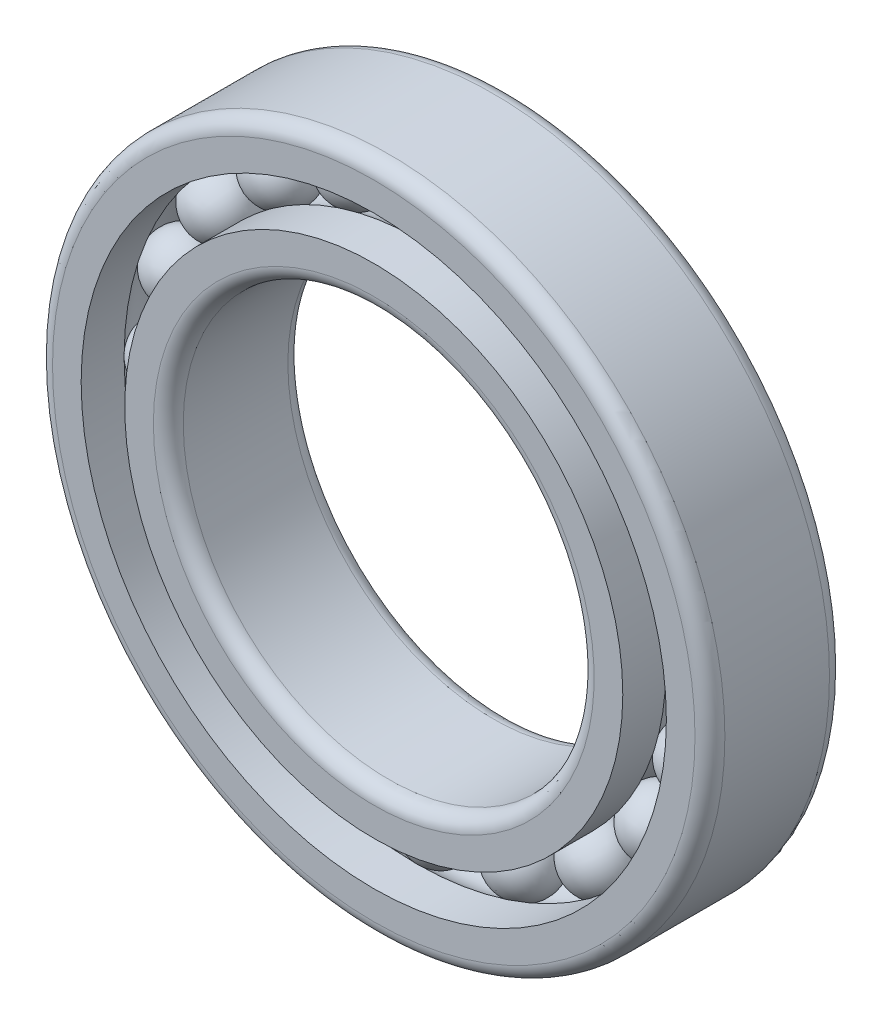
SolidWorks part; units mm, degrees
ref_plane "Front Plane" through (0, 0, 0) normal (0, 0, 1) x (1, 0, 0)
ref_plane "Top Plane" through (0, 0, 0) normal (0, 1, 0) x (1, 0, 0)
ref_plane "Right Plane" through (0, 0, 0) normal (1, 0, 0) x (0, 0, -1)
sketch "BaseSke" plane through (0, 0, 0) normal (1, 0, 0) x (0, 0, -1)
  line L0 (-47.2296, 0) -> (24.6132, 0) construction
  line L1 (-47.2296, 36.25) -> (24.6132, 36.25) construction
  line L2 (0, 129.5214) -> (0, -86.3012) construction
  line L3 (0, 40.625) -> (0, 31.875)
  line L4 (-9, 45) -> (9, 45) construction
  line L5 (-9, 27.5) -> (9, 27.5) construction
  arc A0 (0, 40.625) -> (0, 31.875) centre (0, 36.25) ccw
  dimension "Ball_diameter" = 8.75
  dimension "D1" = 36.25
  dimension "Bearing_Thickness" = 18
  dimension "Bearing_Outside_Diameter" = 90
  dimension "Bearing_Inside_Diameter" = 55
revolve "Ball" add sketch "BaseSke" angle 360 about L3
sketch "OuterRaceSke" plane through (0, 0, 0) normal (1, 0, 0) x (0, 0, -1)
  line L0 (0, 0) -> (0, 87.5396) construction
  line L1 (-9, 45) -> (9, 45)
  line L2 (-9, 45) -> (-9, 39.1667)
  line L3 (-9, 39.1667) -> (-3.2475, 39.1667)
  line L4 (9, 45) -> (9, 39.1667)
  line L5 (-50.3916, 0) -> (55.2197, 0) construction
  line L6 (-47.2296, 36.25) -> (24.6132, 36.25) construction
  line L7 (3.2475, 39.1667) -> (9, 39.1667)
  arc A0 (3.2475, 39.1667) -> (-3.2475, 39.1667) centre (0, 36.25) ccw
  dimension "D4" = 8.73
  dimension "D2" = 78.3333
revolve "OuterRace" add sketch "OuterRaceSke" angle 360 about L5
sketch "InnerRaceSke" plane through (0, 0, 0) normal (1, 0, 0) x (0, 0, -1)
  line L0 (-70.8626, 0) -> (113.5527, 0) construction
  line L1 (0, 58.441) -> (0, -70.8113) construction
  line L2 (-9, 27.5) -> (9, 27.5)
  line L3 (-9, 27.5) -> (-9, 33.3333)
  line L4 (-9, 33.3333) -> (-3.2475, 33.3333)
  line L5 (9, 27.5) -> (9, 33.3333)
  line L6 (0, 129.5214) -> (0, -86.3012) construction
  line L7 (3.2475, 33.3333) -> (9, 33.3333)
  arc A0 (-3.2475, 33.3333) -> (3.2475, 33.3333) centre (0, 36.25) ccw
  arc A1 (0, 40.625) -> (0, 31.875) centre (0, 36.25) ccw construction
  dimension "D2" = 8.73
  dimension "D1" = 66.6667
revolve "InnerRace" add sketch "InnerRaceSke" angle 360 about L0
fillet "Fillet1" radius 2 4 edges at (27.5, 0, -9) (27.5, 0, 9) (45, 0, -9) (45, 0, 9)
sketch "ShieldedSke" plane through (0, 0, 0) normal (1, 0, 0) x (0, 0, -1)
  line L1 (-8, 39.1667) -> (-6, 39.1667)
  line L2 (-9, 38.1667) -> (-9, 34.3333)
  line L3 (-8, 33.3333) -> (-6, 33.3333)
  line L4 (-6, 39.1667) -> (-6, 33.3333)
  arc A0 (-8, 39.1667) -> (-9, 38.1667) centre (-8, 38.1667) ccw
  arc A1 (-9, 34.3333) -> (-8, 33.3333) centre (-8, 34.3333) ccw
  point P12 (-9, 39.1667)
  point P13 (-9, 33.3333)
  dimension "D1" = 1
  dimension "D2" = 6
revolve "Shielded" [suppressed] add sketch "ShieldedSke" angle 360 about L0
mirror "DoubleShielded" [suppressed] about plane through (0, 0, 0) normal (0, 0, 1)
sketch "SealedSke" plane through (0, 0, 0) normal (1, 0, 0) x (0, 0, -1)
  line L0 (-34.5153, 0) -> (39.09, 0) construction
  line L1 (-27.2, 33.3333) -> (-7.2, 33.3333)
  line L2 (-27.2, 33.3333) -> (-27.2, 39.1667)
  line L3 (-27.2, 39.1667) -> (-7.2, 39.1667)
  line L4 (-7.2, 33.3333) -> (-7.2, 39.1667)
  dimension "D1" = 20
  dimension "D2" = 7.2
revolve "Sealed" [suppressed] cut sketch "SealedSke" angle 360 about L0
mirror "DoubleSealed" [suppressed] about plane through (0, 0, 0) normal (0, 0, 1)
pattern_circular "CirPatternBall" count 20 over 360 about axis through (0, 0, 0) along (0, 0, 1) of "Ball"
sketch "CutGrooveSke" plane through (0, 0, 0) normal (1, 0, 0) x (0, 0, -1)
  line L0 (-51.8407, 0) -> (83.8302, 0) construction
  line L1 (5.4, -64.1) -> (4.5, -64.1)
  line L2 (5.4, -64.1) -> (5.4, -44.1)
  line L3 (5.4, -44.1) -> (4.5, -44.1)
  line L4 (4.5, -64.1) -> (4.5, -44.1)
  dimension "D1" = 44.1
  dimension "D2" = 4.5
  dimension "D3" = 0.9
  dimension "D4" = 20
revolve "CutGroove" [suppressed] cut sketch "CutGrooveSke" angle 360 about L0
sketch "TaperSke" plane through (0, 0, 0) normal (1, 0, 0) x (0, 0, -1)
  line L0 (-9, 27.5) -> (9, 27.5)
  line L1 (9, 27.5) -> (9, 29)
  line L2 (9, 29) -> (-9, 27.5)
  line L7 (-41.2502, 0) -> (40.8606, 0) construction
  dimension "Taper" = 1.5
revolve "Taper" [suppressed] cut sketch "TaperSke" angle 360 about L7
fillet "Fillet2" [suppressed] radius 2
sketch "SimplifiedSke" plane through (0, 0, 0) normal (1, 0, 0) x (0, 0, -1)
  line L0 (37.5911, 0) -> (-37.5911, 0) construction
  circle A0 centre (0, 36.25) radius 4.375
  arc A1 (0, 40.625) -> (0, 31.875) centre (0, 36.25) ccw construction
revolve "Simplified" [suppressed] add sketch "SimplifiedSke" angle 360 about L0
equation "\"D1@BaseSke\" =  (\"Bearing_Outside_Diameter@BaseSke\"  +  \"Bearing_Inside_Diameter@BaseSke\"  )  / 4"
equation "\"Ball_diameter@BaseSke\" =  ( \"Bearing_Outside_Diameter@BaseSke\" - \"Bearing_Inside_Diameter@BaseSke\" ) / 4 "
equation "\"D2@OuterRaceSke\" = \"Bearing_Outside_Diameter@BaseSke\" -  ( \"Bearing_Outside_Diameter@BaseSke\" - \"Bearing_Inside_Diameter@BaseSke\" )  / 3"
equation "\"D4@OuterRaceSke\" = (  \"Bearing_Outside_Diameter@BaseSke\" - \"Bearing_Inside_Diameter@BaseSke\" ) / 4 -0.02"
equation "\"D1@InnerRaceSke\" = \"Bearing_Inside_Diameter@BaseSke\" +  ( \"Bearing_Outside_Diameter@BaseSke\" - \"Bearing_Inside_Diameter@BaseSke\" )  / 3"
equation "\"D2@InnerRaceSke\" = \"D4@OuterRaceSke\""
equation "\"D1@ShieldedSke\" = \"Fillet_radius@Fillet1\"/2"
equation "\"D2@ShieldedSke\" = \"Bearing_Thickness@BaseSke\"/3"
equation "\"D2@SealedSke\" = \"Bearing_Thickness@BaseSke\"/2.5"
equation "\"D1@CirPatternBall\" = int( \"D1@BaseSke\"* pi  * 2 / \"Ball_diameter@BaseSke\"/1.2 ) -1"
equation "\"D1@CutGrooveSke\" = \"Bearing_Outside_Diameter@BaseSke\" * 0.49"
equation "\"D2@CutGrooveSke\" = \"Bearing_Thickness@BaseSke\" *0.25"
equation "\"D3@CutGrooveSke\" = \"Bearing_Thickness@BaseSke\"/20"
equation "\"Taper@TaperSke\" = \"Bearing_Thickness@BaseSke\"/12"
equation "\"D1@Fillet2\" = \"Fillet_radius@Fillet1\""
